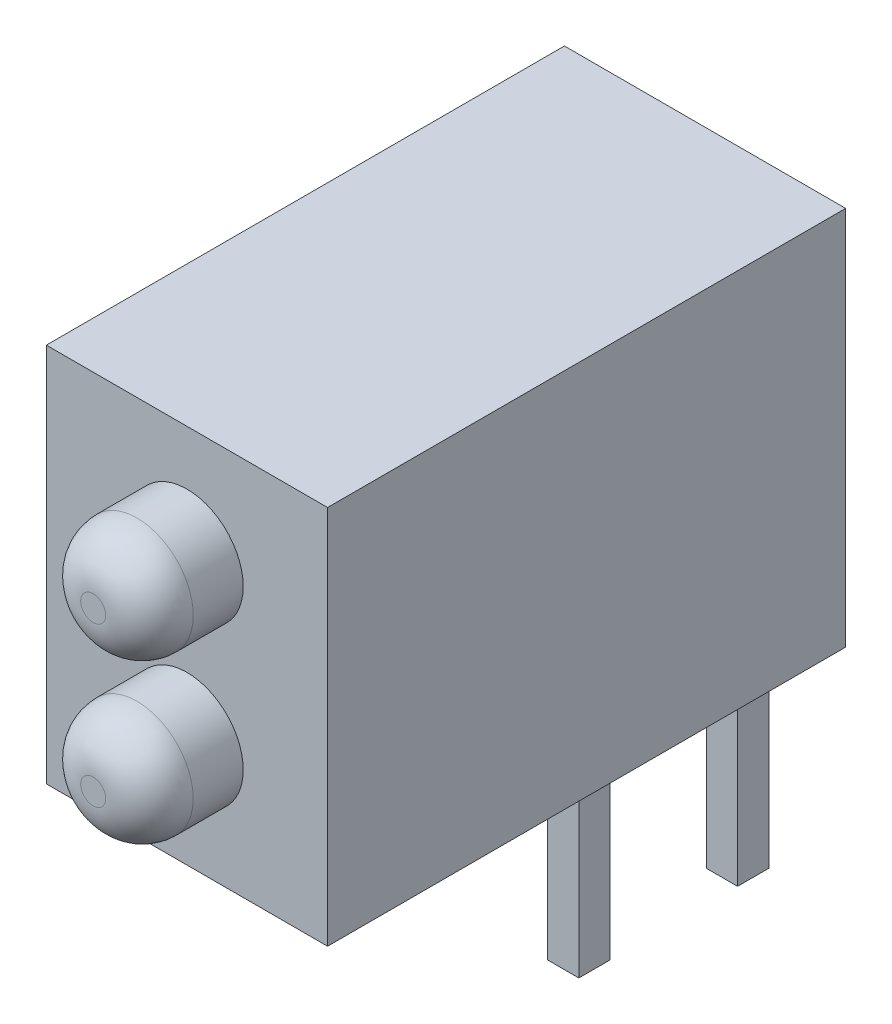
SolidWorks part; units mm, degrees
ref_plane "Front Plane" through (0, 0, 0) normal (0, 0, 1) x (1, 0, 0)
ref_plane "Top Plane" through (0, 0, 0) normal (0, 1, 0) x (1, 0, 0)
ref_plane "Right Plane" through (0, 0, 0) normal (1, 0, 0) x (0, 0, -1)
sketch "Sketch1" plane through (0, 0, 0) normal (0, 0, 1) x (1, 0, 0)
  line L1 (-2.25, 3.04) -> (2.25, 3.04)
  line L2 (-2.25, 3.04) -> (-2.25, -3.04)
  line L3 (-2.25, -3.04) -> (2.25, -3.04)
  line L4 (2.25, 3.04) -> (2.25, -3.04)
  line L5 (-2.25, 3.04) -> (2.25, -3.04) construction
  line L6 (-2.25, -3.04) -> (2.25, 3.04) construction
  point P0 (0, 0)
  dimension "D1" = 4.5
  dimension "D2" = 6.08
extrude "Boss-Extrude1" add sketch "Sketch1" against normal blind 8.29
sketch "Sketch2" plane through (0, 0, 0) normal (0, 0, 1) x (1, 0, 0)
  line L0 (-2.25, -3.04) -> (2.25, -3.04) construction
  circle A0 centre (0, 1.27) radius 0.9
  circle A1 centre (0, -1.27) radius 0.9
  dimension "D1" = 1.8
  dimension "D2" = 1.8
  dimension "D3" = 2.54
  dimension "D4" = 1.77
extrude "Boss-Extrude2" add sketch "Sketch2" along normal blind 1.5
fillet "Fillet1" radius 0.7 2 edges at (0.9, -1.27, 1.5) (0.9, 1.27, 1.5)
sketch "Sketch3" plane through (0, -3.04, 0) normal (0, -1, 0) x (1, 0, 0)
  line L0 (0, 0) -> (0, -10.4059) construction
  line L1 (-1.52, -7.29) -> (-1.02, -7.29)
  line L2 (-1.52, -7.29) -> (-1.52, -7.79)
  line L3 (-1.52, -7.79) -> (-1.02, -7.79)
  line L4 (-1.02, -7.29) -> (-1.02, -7.79)
  line L5 (-1.52, -7.29) -> (-1.02, -7.79) construction
  line L6 (-1.52, -7.79) -> (-1.02, -7.29) construction
  line L7 (1.02, -7.29) -> (1.52, -7.29)
  line L8 (1.02, -7.29) -> (1.02, -7.79)
  line L9 (1.02, -7.79) -> (1.52, -7.79)
  line L10 (1.52, -7.29) -> (1.52, -7.79)
  line L11 (1.02, -7.29) -> (1.52, -7.79) construction
  line L12 (1.02, -7.79) -> (1.52, -7.29) construction
  line L13 (-1.52, -4.75) -> (-1.02, -4.75)
  line L14 (-1.52, -4.75) -> (-1.52, -5.25)
  line L15 (-1.52, -5.25) -> (-1.02, -5.25)
  line L16 (-1.02, -4.75) -> (-1.02, -5.25)
  line L17 (-1.52, -4.75) -> (-1.02, -5.25) construction
  line L18 (-1.52, -5.25) -> (-1.02, -4.75) construction
  line L19 (1.02, -4.75) -> (1.52, -4.75)
  line L20 (1.02, -4.75) -> (1.02, -5.25)
  line L21 (1.02, -5.25) -> (1.52, -5.25)
  line L22 (1.52, -4.75) -> (1.52, -5.25)
  line L23 (1.02, -4.75) -> (1.52, -5.25) construction
  line L24 (1.02, -5.25) -> (1.52, -4.75) construction
  line L25 (-2.25, 0) -> (2.25, 0) construction
  point P0 (-1.27, -7.54)
  point P5 (1.27, -7.54)
  point P10 (-1.27, -5)
  point P15 (1.27, -5)
  dimension "D1" = 2.54
  dimension "D2" = 2.54
  dimension "D3" = 2.54
  dimension "D4" = 5
  dimension "D5" = 0.5
  dimension "D6" = 0.5
  dimension "D7" = 0.5
  dimension "D8" = 0.5
  dimension "D9" = 0.5
  dimension "D10" = 0.5
  dimension "D11" = 0.5
extrude "Boss-Extrude3" add sketch "Sketch3" along normal blind 3.18
